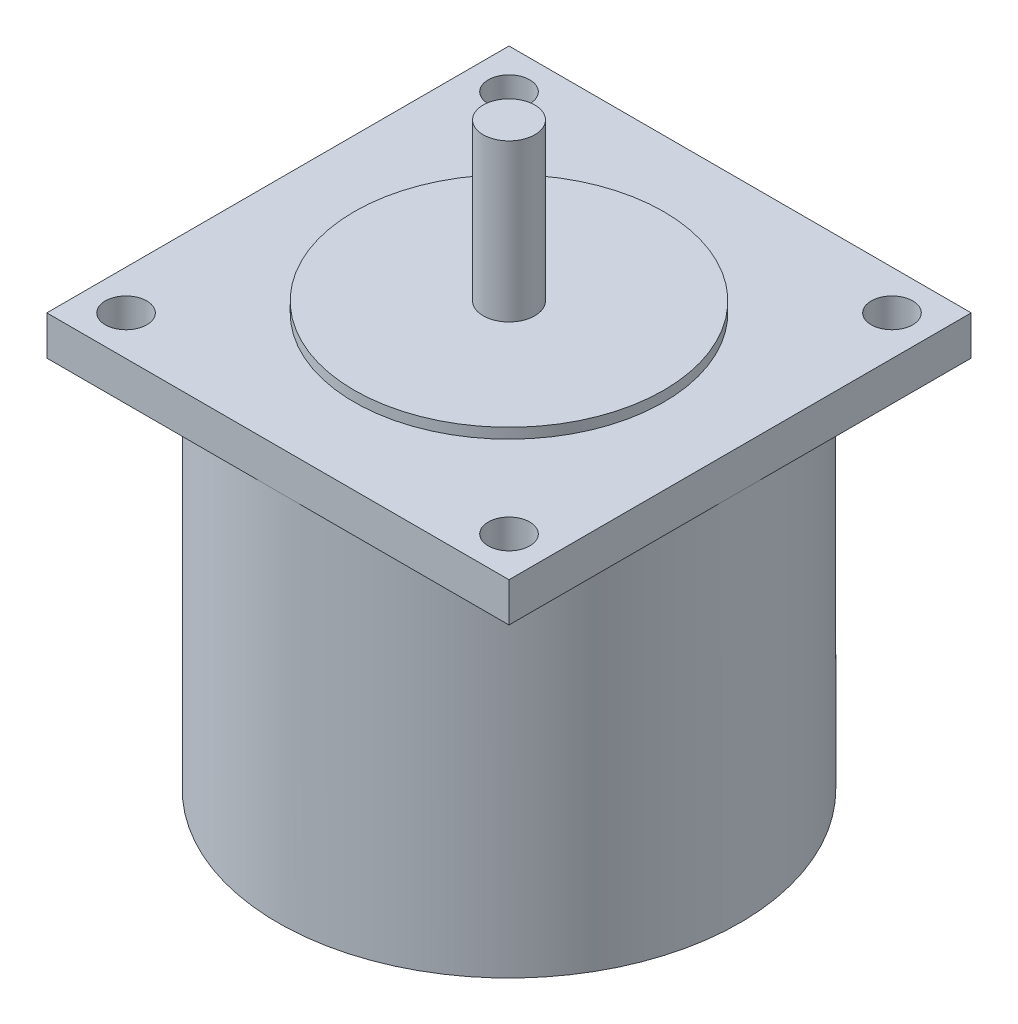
SolidWorks part; units mm, degrees
ref_plane "Front Plane" through (0, 0, 0) normal (0, 0, 1) x (1, 0, 0)
ref_plane "Top Plane" through (0, 0, 0) normal (0, 1, 0) x (1, 0, 0)
ref_plane "Right Plane" through (0, 0, 0) normal (1, 0, 0) x (0, 0, -1)
sketch "Sketch1" plane through (0, 0, 0) normal (0, 1, 0) x (1, 0, 0)
  line L1 (0, 0) -> (56.896, 0)
  line L2 (0, 0) -> (0, 56.896)
  line L3 (0, 56.896) -> (56.896, 56.896)
  line L4 (56.896, 0) -> (56.896, 56.896)
  dimension "D1" = 56.896
  dimension "D2" = 56.896
extrude "Extrude1" add sketch "Sketch1" against normal blind 4.826
sketch "Sketch2" plane through (0, -4.826, 0) normal (0, -1, 0) x (1, 0, 0)
  line L0 (0, -56.896) -> (56.896, 0) construction
  line L1 (56.896, -56.896) -> (0, 0) construction
  circle A0 centre (28.448, -28.448) radius 28.448
  dimension "D1" = 56.896
extrude "Extrude2" add sketch "Sketch2" along normal offset from surface (45.974 mm away) 50.8
sketch "Sketch3" plane through (0, 0, 0) normal (0, 1, 0) x (-1, 0, 0)
  line L0 (0, -56.896) -> (-56.896, 0) construction
  line L1 (-56.896, -56.896) -> (0, 0) construction
  circle A0 centre (-28.448, -28.448) radius 3.175
  dimension "D1" = 6.35
extrude "Extrude3" add sketch "Sketch3" along normal blind 20.574
hole_wizard "#10 Clearance Hole1" positions "Sketch6" profile "Sketch5" hole size "#10" standard "Ansi Inch"
sketch "Sketch6" plane through (0, -4.826, 0) normal (0, -1, 0) x (1, 0, 0)
  line L0 (4.8768, 0) -> (4.8768, -56.896) construction
  line L1 (0, 0) -> (28.448, 0) construction
  line L2 (56.896, -56.896) -> (28.448, -56.896) construction
  line L4 (0, -4.8768) -> (56.896, -4.8768) construction
  line L5 (0, -56.896) -> (0, -28.448) construction
  line L6 (56.896, 0) -> (56.896, -28.448) construction
  line L8 (52.0192, 0) -> (52.0192, -56.896) construction
  line L10 (0, -52.0192) -> (56.896, -52.0192) construction
  point P0 (4.8768, -4.8768)
  point P1 (52.0192, -4.8768)
  point P3 (52.0192, -52.0192)
  point P5 (4.8768, -52.0192)
  dimension "D1" = 4.8768
  dimension "D2" = 4.8768
  dimension "D3" = 4.8768
  dimension "D4" = 4.8768
sketch "Sketch5" plane through (4.8768, -4.826, -4.8768) normal (1, 0, 0) x (0, 0, -1)
  line L0 (0, 0) -> (0, 10.6778)
  line L1 (0, 10.6778) -> (2.5527, 9.144)
  line L2 (2.5527, 9.144) -> (2.5527, 0)
  line L5 (2.5527, 0) -> (0, 0)
  line L10 (0, 10.6778) -> (-2.5527, 9.144) construction
  line L11 (0, -6.35) -> (0, 107.95) construction
  dimension "Hole Dia." = 5.1054
  dimension "Hole Depth" = 9.144
  dimension "Drill Angle" = 118
sketch "Sketch7" plane through (0, 0, 0) normal (0, 1, 0) x (-1, 0, 0)
  line L0 (0, -56.896) -> (-56.896, 0) construction
  line L1 (0, 0) -> (-56.896, -56.896) construction
  circle A0 centre (-28.448, -28.448) radius 19.05
  dimension "D1" = 38.1
extrude "Extrude4" add sketch "Sketch7" along normal blind 1.27
